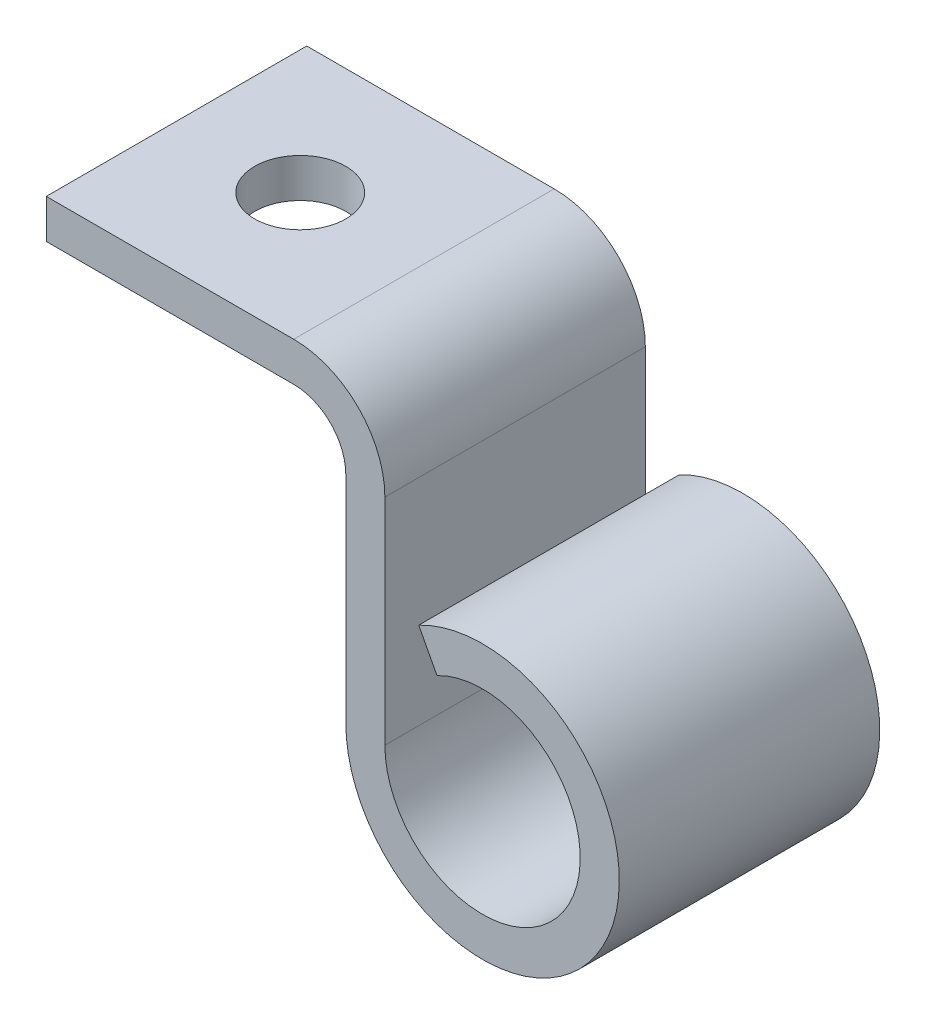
SolidWorks part; units mm, degrees
ref_plane "Front" through (0, 0, 0) normal (0, 0, 1) x (1, 0, 0)
ref_plane "Top" through (0, 0, 0) normal (0, 1, 0) x (1, 0, 0)
ref_plane "Right" through (0, 0, 0) normal (1, 0, 0) x (0, 0, -1)
sketch "Sketch1" plane through (0, 0, 0) normal (0, 0, 1) x (1, 0, 0)
  line L0 (-7.5, 0) -> (-7.5, 16.5)
  line L1 (-14.5, 23.5) -> (-33.5, 23.5)
  arc A0 (-7.5, 0) -> (-3.5, 6.6332) centre (0, 0) ccw
  arc A1 (-7.5, 16.5) -> (-14.5, 23.5) centre (-14.5, 16.5) ccw
  dimension "D1" = 7.5
  dimension "D2" = 23.5
  dimension "D4" = 7
  dimension "D3" = 26
  dimension "D5" = 4
extrude "Extrude-Thin1" add sketch "Sketch1" along normal mid plane 20 thin
sketch "Sketch2" plane through (0, 23.5, 0) normal (0, 1, 0) x (1, 0, 0)
  line L0 (-33.5, 0) -> (-24, 0) construction
  line L1 (-33.5, -10) -> (-33.5, 10) construction
  line L2 (-24, 0) -> (-24, 10) construction
  line L3 (-33.5, 10) -> (-14.5, 10) construction
  circle A0 centre (-24, 0) radius 3.5
  dimension "D1" = 7
extrude "Cut-Extrude1" cut sketch "Sketch2" against normal through all
